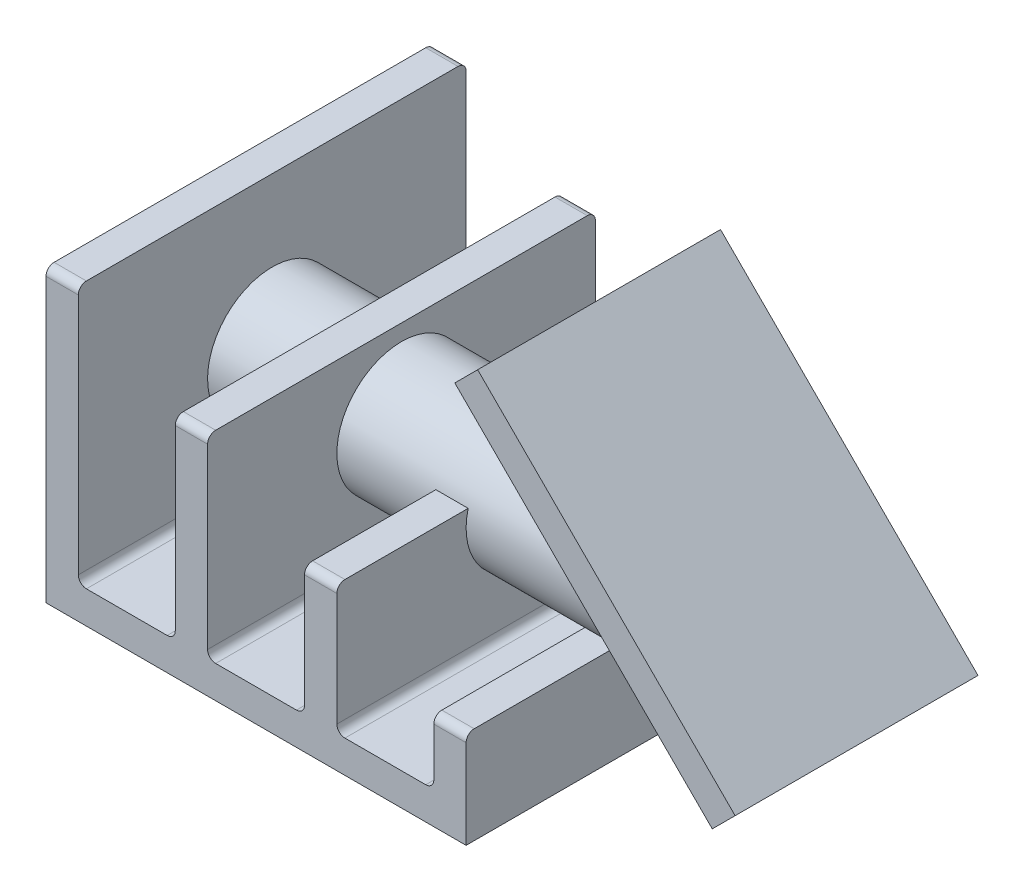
SolidWorks part; units mm, degrees
ref_plane "Front Plane" through (0, 0, 0) normal (0, 0, 1) x (1, 0, 0)
ref_plane "Top Plane" through (0, 0, 0) normal (0, 1, 0) x (1, 0, 0)
ref_plane "Right Plane" through (0, 0, 0) normal (1, 0, 0) x (0, 0, -1)
sketch "Sketch1" plane through (0, 0, 0) normal (0, 0, 1) x (1, 0, 0)
  line L0 (0, 0) -> (0, 114.3)
  line L1 (0, 114.3) -> (12.7, 114.3)
  line L2 (12.7, 114.3) -> (12.7, 12.7)
  line L3 (12.7, 12.7) -> (50.8, 12.7)
  line L4 (50.8, 12.7) -> (50.8, 88.9)
  line L5 (50.8, 88.9) -> (63.5, 88.9)
  line L6 (63.5, 88.9) -> (63.5, 12.7)
  line L7 (63.5, 12.7) -> (101.6, 12.7)
  line L8 (101.6, 12.7) -> (101.6, 63.5)
  line L9 (101.6, 63.5) -> (114.3, 63.5)
  line L10 (114.3, 63.5) -> (114.3, 12.7)
  line L11 (114.3, 12.7) -> (152.4, 12.7)
  line L12 (152.4, 12.7) -> (152.4, 38.1)
  line L13 (152.4, 38.1) -> (165.1, 38.1)
  line L14 (165.1, 38.1) -> (165.1, 0)
  line L15 (165.1, 0) -> (0, 0)
  dimension "D1" = 12.7
  dimension "D2" = 50.8
  dimension "D3" = 101.6
  dimension "D4" = 165.1
  dimension "D5" = 12.7
  dimension "D6" = 38.1
  dimension "D7" = 63.5
  dimension "D8" = 88.9
  dimension "D9" = 114.3
extrude "Extrude1" add sketch "Sketch1" against normal blind 152.4
ref_plane "Plane1" through (101.6, 101.6, 0) normal (0.7071, 0.7071, 0) x (0, 0, -1)
ref_plane "Plane2" through (128.5408, 128.5408, 0) normal (0.7071, 0.7071, 0) x (0, 0, -1)
sketch "Sketch2" plane through (12.7, 0, 0) normal (1, 0, 0) x (0, 0, -1)
  line L0 (152.4, 114.3) -> (0, 114.3) construction
  line L1 (0, 12.7) -> (0, 114.3) construction
  circle A0 centre (76.2, 57.15) radius 25.4
  dimension "D1" = 50.8
  dimension "D2" = 57.15
  dimension "D3" = 76.2
extrude "Extrude2" add sketch "Sketch2" along normal through all
fillet "Fillet1" radius 3.175 14 edges at (6.35, 114.3, -152.4) (57.15, 88.9, -152.4) (107.95, 63.5, -152.4) (158.75, 38.1, -152.4) (158.75, 38.1, 0) (107.95, 63.5, 0) (57.15, 88.9, 0) (6.35, 114.3, 0) (152.4, 12.7, -76.2) (114.3, 12.7, -76.2) (101.6, 12.7, -76.2) (63.5, 12.7, -76.2) (50.8, 12.7, -76.2) (12.7, 12.7, -76.2)
sketch "Sketch3" plane through (128.5408, 128.5408, 0) normal (0.7071, 0.7071, 0) x (0, 0, -1)
  line L1 (29.3703, -3.8855) -> (124.8137, -3.8855)
  line L2 (29.3703, -3.8855) -> (29.3703, -146.9814)
  line L3 (29.3703, -146.9814) -> (124.8137, -146.9814)
  line L4 (124.8137, -3.8855) -> (124.8137, -146.9814)
extrude "Extrude3" add sketch "Sketch3" along normal blind 12.7
